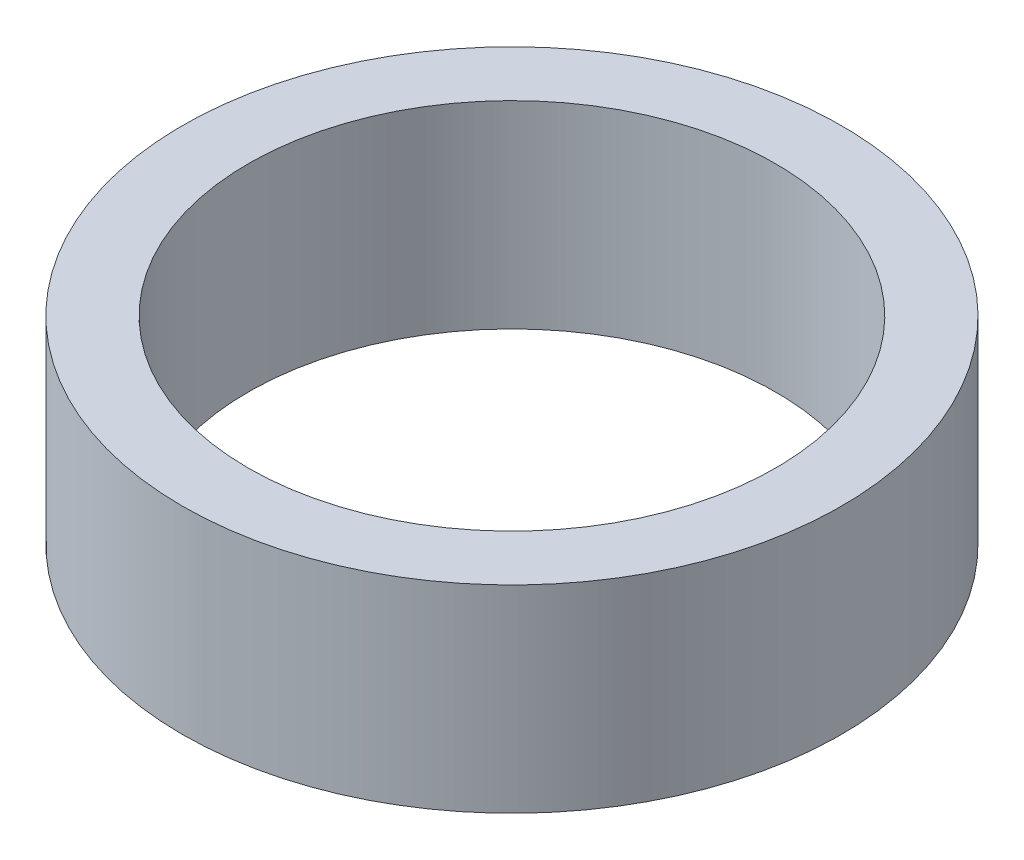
SolidWorks part; units mm, degrees
ref_plane "前视基准面" through (0, 0, 0) normal (0, 0, 1) x (1, 0, 0)
ref_plane "上视基准面" through (0, 0, 0) normal (0, 1, 0) x (1, 0, 0)
ref_plane "右视基准面" through (0, 0, 0) normal (1, 0, 0) x (0, 0, -1)
other "Configuration Table"
sketch "草图1" plane through (0, 0, 0) normal (0, 1, 0) x (1, 0, 0)
  circle A0 centre (0, 0) radius 5
  dimension "D1" = 10
extrude "凸台-拉伸1" add sketch "草图1" along normal blind 3
sketch "草图2" plane through (0, 3, 0) normal (0, 1, 0) x (1, 0, 0)
  circle A0 centre (0, 0) radius 4
  dimension "D1" = 8
extrude "切除-拉伸1" cut sketch "草图2" against normal through all
